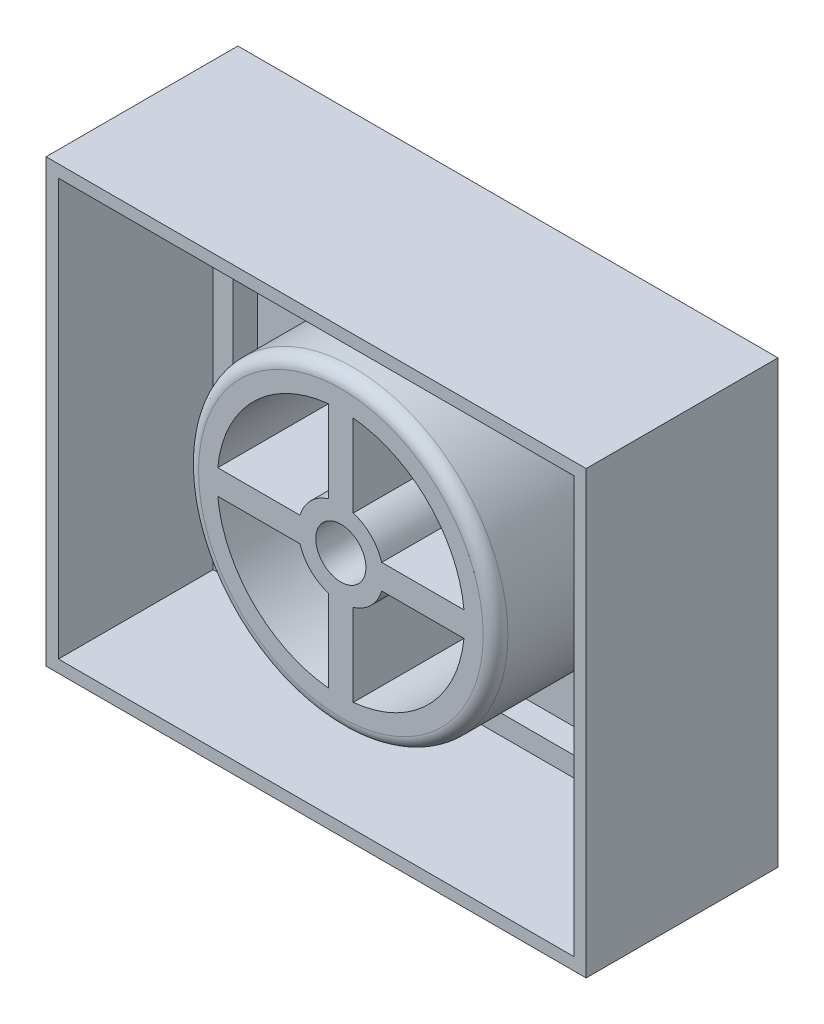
SolidWorks part; units mm, degrees
ref_plane "Front Plane" through (0, 0, 0) normal (0, 0, 1) x (1, 0, 0)
ref_plane "Top Plane" through (0, 0, 0) normal (0, 1, 0) x (1, 0, 0)
ref_plane "Right Plane" through (0, 0, 0) normal (1, 0, 0) x (0, 0, -1)
sketch "Sketch1" plane through (0, 0, 0) normal (0, 0, 1) x (1, 0, 0)
  line L0 (-10.186, 5.2158) -> (14.814, 5.2158) construction
  line L1 (-3.5822, 3.2158) -> (9.7137, 3.2158)
  line L2 (-3.5822, 7.2158) -> (9.7137, 7.2158)
  line L3 (-10.186, 7.2158) -> (14.814, 7.2158) construction
  line L4 (-10.186, 3.2158) -> (14.814, 3.2158) construction
  line L5 (-12.186, -1.388) -> (-12.186, -14.6839)
  line L6 (-8.186, -1.388) -> (-8.186, -14.6839)
  line L7 (-10.186, 5.2158) -> (-10.186, -19.7842) construction
  line L8 (-16.7898, 7.2158) -> (-30.0858, 7.2158)
  line L9 (-16.7898, 3.2158) -> (-30.0858, 3.2158)
  line L10 (-10.186, 5.2158) -> (-35.186, 5.2158) construction
  line L11 (-8.186, 11.8196) -> (-8.186, 25.1156)
  line L12 (-12.186, 11.8196) -> (-12.186, 25.1156)
  line L13 (-10.186, 5.2158) -> (-10.186, 30.2158) construction
  circle A0 centre (-10.186, 5.2158) radius 25
  arc A1 (-30.0858, 3.2158) -> (-12.186, -14.6839) centre (-10.186, 5.2158) ccw
  circle A3 centre (-10.186, 5.2158) radius 4.05
  arc A4 (-16.7898, 3.2158) -> (-12.186, -1.388) centre (-10.186, 5.2158) ccw
  circle A5 centre (-10.186, 5.2158) radius 20 construction
  circle A6 centre (-10.186, 5.2158) radius 6.9 construction
  arc A7 (-8.186, -1.388) -> (-3.5822, 3.2158) centre (-10.186, 5.2158) ccw
  arc A8 (-8.186, -14.6839) -> (9.7137, 3.2158) centre (-10.186, 5.2158) ccw
  arc A9 (9.7137, 7.2158) -> (-8.186, 25.1156) centre (-10.186, 5.2158) ccw
  arc A10 (-3.5822, 7.2158) -> (-8.186, 11.8196) centre (-10.186, 5.2158) ccw
  arc A11 (-12.186, 25.1156) -> (-30.0858, 7.2158) centre (-10.186, 5.2158) ccw
  arc A12 (-12.186, 11.8196) -> (-16.7898, 7.2158) centre (-10.186, 5.2158) ccw
  point P34 (-10.186, 5.2158)
  dimension "D1" = 5
  dimension "D3" = 2
  dimension "D2" = 8.1
  dimension "D6" = 50
  dimension "D4" = 2
  dimension "D5" = 4
extrude "Boss-Extrude1" add sketch "Sketch1" along normal blind 25
sketch "Sketch2" plane through (0, 0, 0) normal (0, 0, -1) x (-1, 0, 0)
  line L1 (-33.4619, -30.4368) -> (53.8339, -30.4368)
  line L2 (-33.4619, -30.4368) -> (-33.4619, 40.8684)
  line L3 (-33.4619, 40.8684) -> (53.8339, 40.8684)
  line L4 (53.8339, -30.4368) -> (53.8339, 40.8684)
  line L5 (-33.4619, -30.4368) -> (53.8339, 40.8684) construction
  line L6 (-33.4619, 40.8684) -> (53.8339, -30.4368) construction
  point P0 (10.186, 5.2158)
extrude "Boss-Extrude2" add sketch "Sketch2" along normal blind 2
sketch "Sketch3" plane through (0, 0, 0) normal (0, 0, 1) x (1, 0, 0)
  line L0 (33.4619, -30.4368) -> (-53.8339, -30.4368) construction
  line L1 (33.4619, 40.8684) -> (33.4619, -30.4368) construction
  line L2 (-53.8339, 40.8684) -> (33.4619, 40.8684) construction
  line L3 (-53.8339, -30.4368) -> (-53.8339, 40.8684) construction
  line L4 (33.4619, -30.4368) -> (-53.8339, -30.4368)
  line L5 (33.4619, 40.8684) -> (33.4619, -30.4368)
  line L6 (-53.8339, 40.8684) -> (33.4619, 40.8684)
  line L7 (-53.8339, -30.4368) -> (-53.8339, 40.8684)
  line L8 (-51.8339, 38.8684) -> (31.4619, 38.8684)
  line L9 (31.4619, 38.8684) -> (31.4619, -28.4368)
  line L10 (31.4619, -28.4368) -> (-51.8339, -28.4368)
  line L11 (-51.8339, -28.4368) -> (-51.8339, 38.8684)
  dimension "D1" = 2
extrude "Boss-Extrude3" add sketch "Sketch3" along normal blind 29 contours L4 L7 L6 L5 | L11 L8 L9 L10
sketch "Sketch4" plane through (0, 0, 0) normal (0, 0, 1) x (1, 0, 0)
  line L11 (31.4619, 38.8684) -> (-51.8339, 38.8684)
  line L12 (-51.8339, 38.8684) -> (-51.8339, -28.4368)
  line L13 (-51.8339, -28.4368) -> (31.4619, -28.4368)
  line L14 (31.4619, -28.4368) -> (31.4619, 38.8684)
  line L15 (-48.6339, -25.2368) -> (28.2619, -25.2368)
  line L16 (28.2619, -25.2368) -> (28.2619, 35.6684)
  line L17 (28.2619, 35.6684) -> (-48.6339, 35.6684)
  line L18 (-48.6339, 35.6684) -> (-48.6339, -25.2368)
  line L19 (-48.6339, -25.2368) -> (28.2619, -25.2368)
  line L20 (28.2619, -25.2368) -> (28.2619, 35.6684)
  line L21 (28.2619, 35.6684) -> (-48.6339, 35.6684)
  line L22 (-48.6339, 35.6684) -> (-48.6339, -25.2368)
  dimension "D1" = 3.2
  dimension "D2" = 3.2
extrude "Boss-Extrude4" add sketch "Sketch4" along normal blind 4
fillet "Fillet1" radius 2 1 edges at (14.814, 5.2158, 25)
